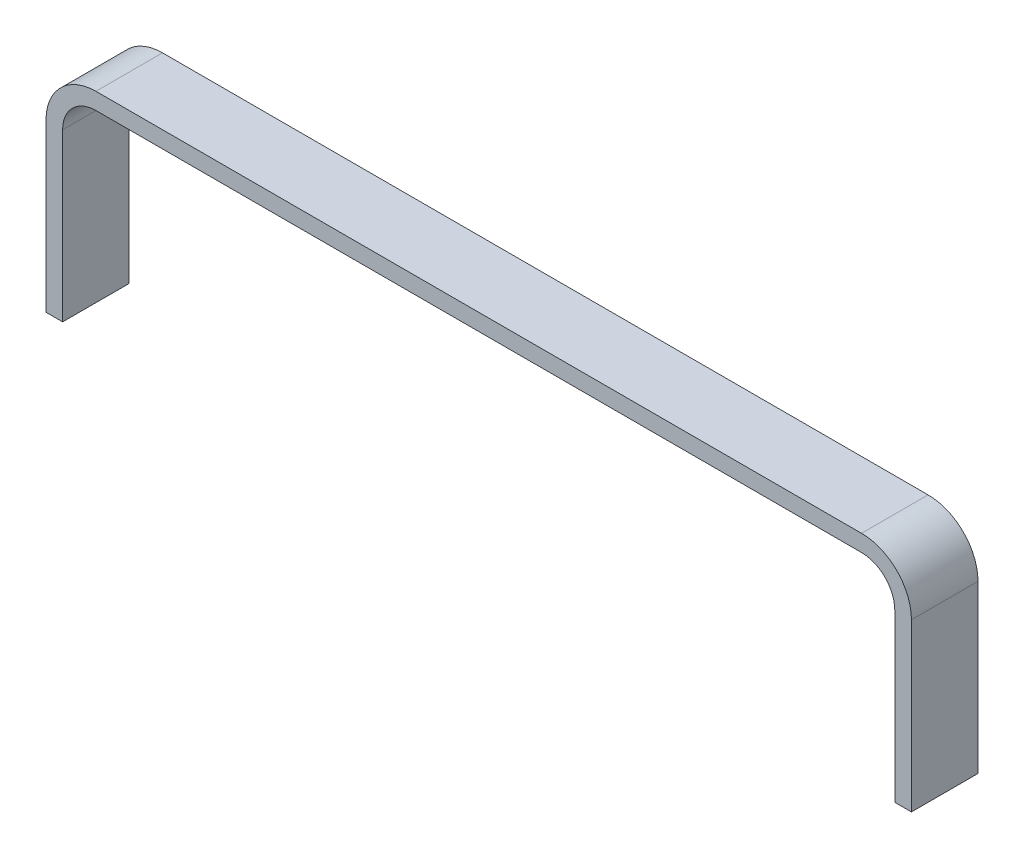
SolidWorks part; units mm, degrees
ref_plane "Plan1" through (0, 0, 0) normal (0, 0, 1) x (1, 0, 0)
ref_plane "Plan2" through (0, 0, 0) normal (0, 1, 0) x (1, 0, 0)
ref_plane "Plan3" through (0, 0, 0) normal (1, 0, 0) x (0, 0, -1)
sketch "Esquisse1" plane through (0, 0, 0) normal (0, 0, 1) x (1, 0, 0)
  line L0 (0, 0) -> (5, 0)
  line L1 (5, 0) -> (5, 50)
  line L2 (15, 60) -> (245, 60)
  line L3 (255, 50) -> (255, 0)
  line L4 (255, 0) -> (260, 0)
  line L5 (260, 0) -> (260, 50)
  line L6 (245, 65) -> (15, 65)
  line L7 (0, 50) -> (0, 0)
  arc A0 (15, 60) -> (5, 50) centre (15, 50) ccw
  arc A1 (255, 50) -> (245, 60) centre (245, 50) ccw
  arc A2 (15, 65) -> (0, 50) centre (15, 50) ccw
  arc A3 (260, 50) -> (245, 65) centre (245, 50) ccw
  dimension "D6" = 10
  dimension "D7" = 15
  dimension "D1" = 250
  dimension "D2" = 5
  dimension "D3" = 5
  dimension "D4" = 5
  dimension "D5" = 60
extrude "Extrusion1" add sketch "Esquisse1" along normal blind 20
